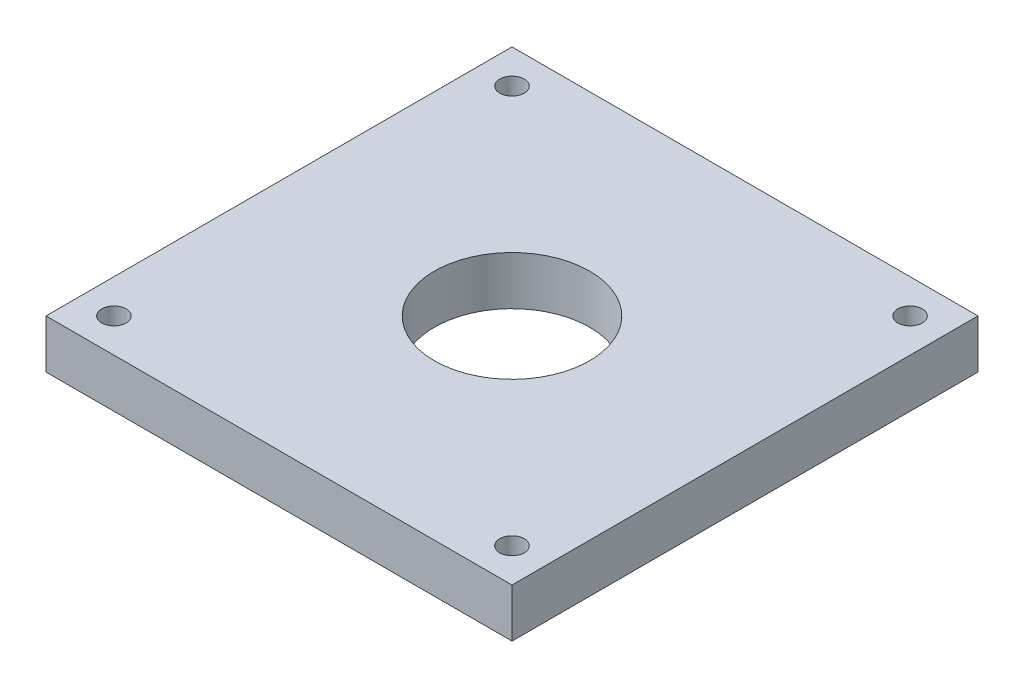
SolidWorks part; units mm, degrees
ref_plane "Front Plane" through (0, 0, 0) normal (0, 0, 1) x (1, 0, 0)
ref_plane "Top Plane" through (0, 0, 0) normal (0, 1, 0) x (1, 0, 0)
ref_plane "Right Plane" through (0, 0, 0) normal (1, 0, 0) x (0, 0, -1)
sketch "Sketch1" plane through (0, 0, 0) normal (0, 1, 0) x (1, 0, 0)
  line L1 (-62.3953, 40.8177) -> (13.8047, 40.8177)
  line L2 (-62.3953, 40.8177) -> (-62.3953, -35.3823)
  line L3 (-62.3953, -35.3823) -> (13.8047, -35.3823)
  line L4 (13.8047, 40.8177) -> (13.8047, -35.3823)
  dimension "D1" = 76.2
  dimension "D2" = 76.2
extrude "Boss-Extrude1" add sketch "Sketch1" along normal blind 7.9502
sketch "Sketch2" plane through (0, 7.9502, 0) normal (0, 1, 0) x (-1, 0, 0)
  line L0 (-13.8047, -40.8177) -> (62.3953, -40.8177) construction
  line L1 (62.3953, -40.8177) -> (62.3953, 35.3823) construction
  line L2 (62.3953, 35.3823) -> (-13.8047, 35.3823) construction
  line L3 (-13.8047, 35.3823) -> (-13.8047, -40.8177) construction
  circle A0 centre (56.839, -35.2614) radius 2
  circle A1 centre (56.839, 29.8261) radius 2
  circle A2 centre (-8.2485, 29.8261) radius 2
  circle A3 centre (-8.2485, -35.2614) radius 2
  dimension "D1" = 4
  dimension "D2" = 4
  dimension "D3" = 4
  dimension "D4" = 4
  dimension "D5" = 5.5562
  dimension "D6" = 5.5562
  dimension "D7" = 5.5562
  dimension "D8" = 5.5562
  dimension "D9" = 5.5562
  dimension "D10" = 5.5562
  dimension "D11" = 5.5562
  dimension "D12" = 5.5562
hole_wizard "Ø4.0 (4) Diameter Hole1" positions "3DSketch1" profile "Sketch3" hole size "Ø4.0" standard "Ansi Metric"
sketch3d "3DSketch1"
  point P0 (-56.839, 7.9502, -35.2614)
  point P3 (8.2485, 7.9502, -35.2614)
  point P6 (-56.839, 7.9502, 29.8261)
  point P9 (8.2485, 7.9502, 29.8261)
sketch "Sketch3" plane through (-56.839, 7.9502, -35.2614) normal (1, 0, 0) x (0, 0, 1)
  line L0 (0, 0) -> (0, 13.9017)
  line L1 (0, 13.9017) -> (2, 12.7)
  line L2 (2, 12.7) -> (2, 0)
  line L5 (2, 0) -> (0, 0)
  line L10 (0, 13.9017) -> (-2, 12.7) construction
  line L11 (0, -6.35) -> (0, 107.95) construction
  dimension "Hole Dia." = 4
  dimension "Hole Depth" = 12.7
  dimension "Drill Angle" = 118
sketch "Sketch4" plane through (0, 7.9502, 0) normal (0, 1, 0) x (-1, 0, 0)
  line L0 (-13.8047, 35.3823) -> (-13.8047, -40.8177) construction
  line L1 (-13.8047, -40.8177) -> (62.3953, -40.8177) construction
  circle A0 centre (24.2953, -2.7177) radius 12.7
  dimension "D3" = 25.4
  dimension "D1" = 38.1
  dimension "D2" = 38.1
extrude "Cut-Extrude1" cut sketch "Sketch4" against normal through all
